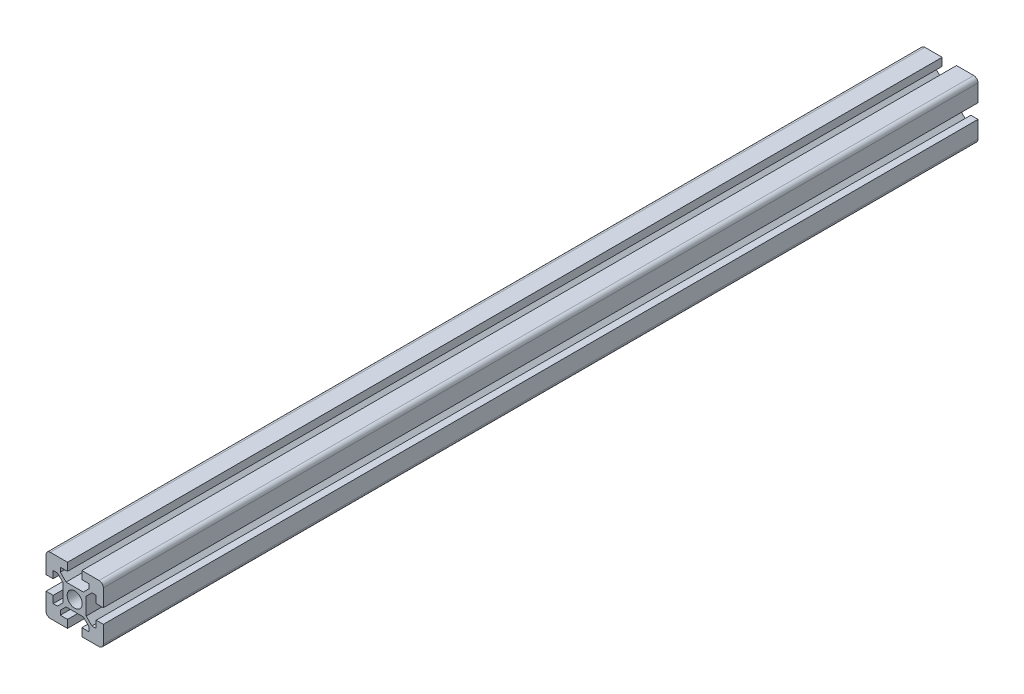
SolidWorks part; units mm, degrees
ref_plane "前基準面" through (0, 0, 0) normal (0, 0, 1) x (1, 0, 0)
ref_plane "上基準面" through (0, 0, 0) normal (0, 1, 0) x (1, 0, 0)
ref_plane "右基準面" through (0, 0, 0) normal (1, 0, 0) x (0, 0, -1)
sketch "草圖1" plane through (0, 0, 0) normal (0, 0, 1) x (1, 0, 0)
  line L0 (15, -5.5) -> (10, -5.5)
  line L1 (3, 0) -> (15, 0)
  line L2 (0, -3) -> (0, -15)
  line L3 (3, -40) -> (15, -40)
  line L4 (40, -3) -> (40, -15)
  line L5 (24.67, -40) -> (37, -40)
  line L6 (15, 0) -> (15, -5.5)
  line L7 (25, 0) -> (37, 0)
  line L8 (25, 0) -> (25, -5.5)
  line L9 (10, -5.5) -> (10, -8.5)
  line L10 (10, -8.5) -> (14, -12.5)
  line L11 (14, -12.5) -> (26, -12.5)
  line L12 (26, -12.5) -> (30, -8.5)
  line L13 (30, -8.5) -> (30, -5.5)
  line L14 (30, -5.5) -> (25, -5.5)
  line L17 (0, -25) -> (0, -37)
  line L18 (30, -34.5) -> (25, -34.5)
  line L19 (30, -31.5) -> (30, -34.5)
  line L20 (26, -27.5) -> (30, -31.5)
  line L21 (14, -27.5) -> (26, -27.5)
  line L22 (10, -31.5) -> (14, -27.5)
  line L23 (10, -34.5) -> (10, -31.5)
  line L24 (25, -40) -> (25, -34.5)
  line L25 (5, -15) -> (5, -10)
  line L26 (0, -15) -> (5, -15)
  line L27 (15, -40) -> (15, -34.5)
  line L28 (0, -25) -> (5, -25)
  line L29 (15, -34.5) -> (10, -34.5)
  line L30 (5, -10) -> (8, -10)
  line L31 (8, -10) -> (12, -14)
  line L32 (12, -14) -> (12, -26)
  line L33 (12, -26) -> (8, -30)
  line L34 (8, -30) -> (5, -30)
  line L35 (5, -30) -> (5, -25)
  line L36 (35, -30) -> (35, -25)
  line L37 (32, -30) -> (35, -30)
  line L38 (28, -26) -> (32, -30)
  line L39 (28, -14) -> (28, -26)
  line L40 (32, -10) -> (28, -14)
  line L41 (35, -10) -> (32, -10)
  line L42 (40, -25) -> (35, -25)
  line L43 (40, -15) -> (35, -15)
  line L44 (35, -15) -> (35, -10)
  line L45 (40, -25) -> (40, -37)
  circle A0 centre (20, -20) radius 5.25
  arc A1 (37, -40) -> (40, -37) centre (37, -37) ccw
  arc A2 (0, -37) -> (3, -40) centre (3, -37) ccw
  arc A3 (37, 0) -> (40, -3) centre (37, -3) cw
  arc A4 (3, 0) -> (0, -3) centre (3, -3) ccw
  point P52 (0, -40)
  point P55 (40, 0)
  point P58 (0, 0)
  dimension "D23" = 10.5
  dimension "D26" = 3
  dimension "D1" = 40
  dimension "D2" = 40
  dimension "D3" = 10
  dimension "D4" = 20
  dimension "D5" = 5
  dimension "D6" = 7
  dimension "D7" = 7
  dimension "D8" = 5.5
  dimension "D9" = 12
  dimension "D10" = 4
  dimension "D11" = 4
  dimension "D12" = 20
  dimension "D13" = 10
  dimension "D14" = 5
  dimension "D15" = 5
  dimension "D16" = 7
  dimension "D17" = 12
  dimension "D18" = 4
  dimension "D19" = 3
  dimension "D20" = 3
  dimension "D21" = 15
  dimension "D22" = 15
  dimension "D24" = 20
  dimension "D25" = 20
extrude "填料-伸長1" add sketch "草圖1" along normal blind 610 contours L1 A4 L2 L26 L25 L30 L31 L32 L33 L34 L35 L28 L17 A2 L3 L27 L29 L23 L22 L21 L20 L19 L18 L24 L5 A1 L45 L42 L36 L37 L38 L39 L40 L41 L44 L43 L4 A3 L7 L8 L14 L13 L12 L11 L10 L9 L0 L6 A0
